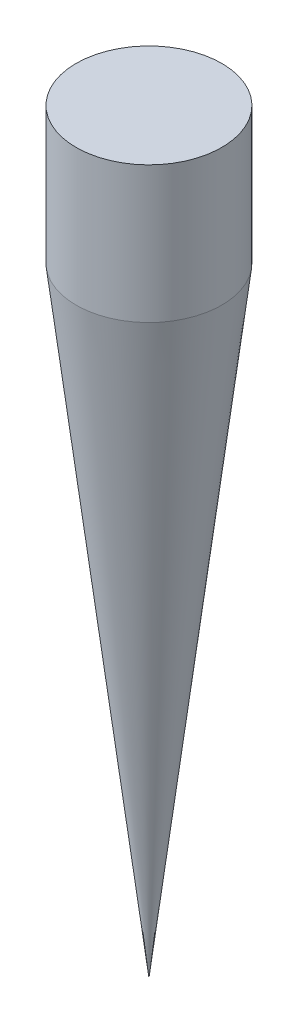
SolidWorks part; units mm, degrees
ref_plane "Front Plane" through (0, 0, 0) normal (0, 0, 1) x (1, 0, 0)
ref_plane "Top Plane" through (0, 0, 0) normal (0, 1, 0) x (1, 0, 0)
ref_plane "Right Plane" through (0, 0, 0) normal (1, 0, 0) x (0, 0, -1)
sketch "Sketch1" plane through (0, 0, 0) normal (0, 0, 1) x (1, 0, 0)
  line L0 (0, 0) -> (0, -34)
  line L1 (0, -34) -> (4, 0)
  line L2 (4, 0) -> (0, 0)
  dimension "D1" = 34
  dimension "D2" = 4
revolve "Revolve1" add sketch "Sketch1" angle 360 about L0
sketch "Sketch2" plane through (0, 0, 0) normal (0, 0, 1) x (1, 0, 0)
  line L0 (0, 0) -> (0, -34)
sketch "Sketch3" plane through (0, 0, 0) normal (0, 1, 0) x (1, 0, 0)
  circle A0 centre (0, 0) radius 4
  circle A1 centre (0, 0) radius 4 construction
extrude "Boss-Extrude1" add sketch "Sketch3" along normal blind 7.5
